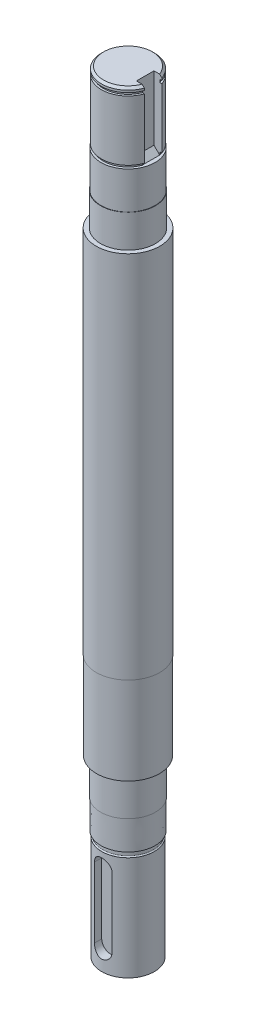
SolidWorks part; units mm, degrees
ref_plane "前视基准面" through (0, 0, 0) normal (0, 0, 1) x (1, 0, 0)
ref_plane "上视基准面" through (0, 0, 0) normal (0, 1, 0) x (1, 0, 0)
ref_plane "右视基准面" through (0, 0, 0) normal (1, 0, 0) x (0, 0, -1)
sketch "草图1" plane through (0, 0, 0) normal (0, 0, 1) x (1, 0, 0)
  line L0 (0, 326.057) -> (0, 371.1505) construction
  line L1 (0, 0) -> (12, 0)
  line L2 (12, 0) -> (12, 50)
  line L3 (12, 50) -> (12.35, 50)
  line L4 (12.5, 79.5) -> (12.5, 63.3)
  line L5 (12.5, 79.5) -> (14.4, 79.5)
  line L6 (14.5, 119.5) -> (14.5, 288)
  line L7 (14.5, 288) -> (12.5, 288)
  line L8 (12.5, 288) -> (12.5, 303)
  line L9 (14.5, 119.5) -> (14.4, 119.5)
  line L10 (14.4, 119.5) -> (14.4, 79.5)
  line L11 (12.35, 50) -> (12.3427, 63.3)
  line L12 (12.5, 63.3) -> (12.3427, 63.3)
  line L13 (12.5, 303) -> (12.35, 303)
  line L14 (12.35, 303) -> (12.35, 320)
  line L15 (12.35, 320) -> (11.2573, 320)
  line L16 (11.2573, 320) -> (11.2573, 321.3)
  line L17 (11.2573, 321.3) -> (12.15, 321.3)
  line L18 (12.15, 348.7) -> (12.15, 321.3)
  line L19 (11.25, 350) -> (11.25, 348.7)
  line L20 (11.25, 348.7) -> (12.15, 348.7)
  line L21 (12.15, 350) -> (12.15, 352)
  line L22 (12.15, 352) -> (0, 352)
  line L23 (12.15, 350) -> (11.25, 350)
  line L24 (0, 0) -> (0, 326.057) construction
  line L25 (0, 0) -> (0, 352)
  dimension "D15" = 1.3
  dimension "D1" = 12
  dimension "D2" = 30
  dimension "D3" = 32
  dimension "D4" = 12.35
  dimension "D5" = 352
  dimension "D6" = 16.2
  dimension "D7" = 12.5
  dimension "D8" = 1.3
  dimension "D9" = 12.5
  dimension "D10" = 12.35
  dimension "D11" = 15
  dimension "D12" = 40
  dimension "D13" = 208.5
  dimension "D14" = 12.15
revolve "旋转2" add sketch "草图1" angle 360 about L0
chamfer "倒角2" distance 1 angle 45 1 edges at (0, 352, -12.15)
sketch "草图5" plane through (0, 0, 0) normal (0, 0, 1) x (1, 0, 0)
  line L0 (0, 0) -> (0, 50) construction
  line L1 (-12, 50) -> (12, 50) construction
  line L2 (12, 50) -> (12, 47.5)
  line L3 (12, 0) -> (12, 50) construction
  line L4 (12, 47.5) -> (11.99, 47.5)
  line L5 (11.5, 47.99) -> (11.5, 49.51)
  line L6 (11.99, 50) -> (12, 50)
  arc A0 (11.99, 47.5) -> (11.5, 47.99) centre (11.99, 47.99) cw
  arc A1 (11.5, 49.51) -> (11.99, 50) centre (11.99, 49.51) cw
  point P16 (11.5, 50)
  dimension "D1" = 0.49
revolve "切除-旋转1" cut sketch "草图5" angle 360 about L0
ref_plane "基准面1" through (0, 0, 12) normal (0, 0, 1) x (1, 0, 0)
sketch "草图6" plane through (0, 0, 12) normal (0, 0, 1) x (1, 0, 0)
  line L0 (0, 0) -> (0, 5) construction
  line L1 (0, 5) -> (0, 25) construction
  line L2 (0, 9) -> (0, 41) construction
  line L4 (-4, 9) -> (-4, 41)
  line L5 (4, 9) -> (4, 41)
  arc A0 (-4, 9) -> (4, 9) centre (0, 9) ccw
  arc A1 (4, 41) -> (-4, 41) centre (0, 41) ccw
  point P6 (0, 45)
  point P7 (0, 5)
  point P8 (0, 25)
  dimension "D1" = 8
  dimension "D2" = 40
  dimension "D3" = 5
extrude "切除-拉伸1" cut sketch "草图6" against normal blind 4
ref_plane "基准面3" through (12.15, 0, 0) normal (1, 0, 0) x (0, 0, -1)
sketch "草图8" plane through (12.15, 0, 0) normal (1, 0, 0) x (0, 0, -1)
  line L0 (0, 320) -> (0, 352) construction
  line L1 (12.35, 320) -> (-12.35, 320) construction
  line L2 (11.15, 352) -> (-11.15, 352) construction
  line L3 (-4, 320) -> (4, 320)
  line L4 (-4, 320) -> (-4, 352)
  line L5 (-4, 352) -> (4, 352)
  line L6 (4, 320) -> (4, 352)
extrude "切除-拉伸3" cut sketch "草图8" against normal blind 4.3
chamfer "倒角3" distance 2.6 1 edges at (7.85, 320, 0)
